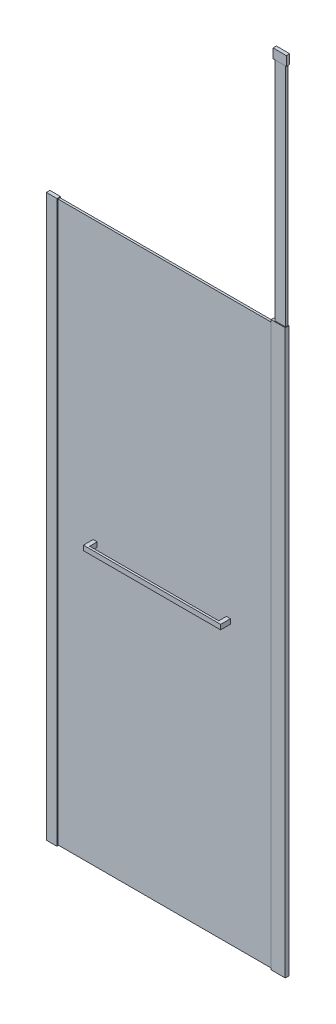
SolidWorks part; units mm, degrees
ref_plane "Płaszczyzna przednia" through (0, 0, 0) normal (0, 0, 1) x (1, 0, 0)
ref_plane "Płaszczyzna górna" through (0, 0, 0) normal (0, 1, 0) x (1, 0, 0)
ref_plane "Płaszczyzna prawa" through (0, 0, 0) normal (1, 0, 0) x (0, 0, -1)
sketch "Szkic1" plane through (0, 0, 0) normal (0, 1, 0) x (1, 0, 0)
  line L0 (0, 0) -> (0, 13.3)
  line L1 (0, 13.3) -> (40, 13.3)
  line L2 (40, 13.3) -> (40, 11.4)
  line L3 (40, 11.4) -> (6.5, 11.4)
  line L4 (6.5, 11.4) -> (6.5, 3.4)
  line L5 (6.5, 3.4) -> (40, 3.4)
  line L6 (40, 3.4) -> (40, 0)
  line L7 (40, 0) -> (0, 0)
  dimension "D1" = 40
  dimension "D2" = 13.3
  dimension "D3" = 33.5
  dimension "D4" = 1.9
  dimension "D5" = 8
extrude "Dodanie-wyciągnięcie1" add sketch "Szkic1" along normal blind 2100 from offset 3
sketch "Szkic2" plane through (0, 3, 0) normal (0, -1, 0) x (1, 0, 0)
  line L0 (6.5, -11.4) -> (40, -11.4) construction
  line L1 (6.5, -3.4) -> (853.5, -3.4)
  line L2 (6.5, -3.4) -> (6.5, -11.4)
  line L3 (6.5, -11.4) -> (853.5, -11.4)
  line L4 (853.5, -3.4) -> (853.5, -11.4)
  dimension "D1" = 847
extrude "Dodanie-wyciągnięcie2" add sketch "Szkic2" against normal blind 2100 separate body
sketch "Szkic3" plane through (0, 3, 0) normal (0, -1, 0) x (1, 0, 0)
  line L0 (843.4, -3.4) -> (843.4, -0.4)
  line L1 (853.5, -3.4) -> (6.5, -3.4) construction
  line L2 (843.4, -0.4) -> (896.4, -0.4)
  line L3 (896.4, -0.4) -> (896.4, -14.4)
  line L4 (896.4, -14.4) -> (843.4, -14.4)
  line L5 (843.4, -14.4) -> (843.4, -11.4)
  line L6 (843.4, -11.4) -> (853.5, -11.4)
  line L7 (853.5, -11.4) -> (853.5, -3.4)
  line L8 (853.5, -3.4) -> (843.4, -3.4)
  line L9 (6.5, -11.4) -> (853.5, -11.4) construction
  line L10 (853.5, -11.4) -> (853.5, -3.4) construction
  dimension "D1" = 10.1
  dimension "D2" = 3
  dimension "D3" = 3
  dimension "D4" = 53
extrude "Dodanie-wyciągnięcie3" add sketch "Szkic3" against normal blind 2108 separate body
sketch "Szkic4" plane through (0, 2103, 0) normal (0, 1, 0) x (1, 0, 0)
  line L1 (0, 13.3) -> (40, 13.3)
  line L2 (0, 13.3) -> (0, 0)
  line L3 (0, 0) -> (40, 0)
  line L4 (40, 13.3) -> (40, 0)
extrude "Dodanie-wyciągnięcie4" add sketch "Szkic4" along normal blind 3
sketch "Szkic5" plane through (0, 2111, 0) normal (0, 1, 0) x (1, 0, 0)
  line L1 (896.4, 14.4) -> (843.4, 14.4)
  line L2 (896.4, 14.4) -> (896.4, 0.4)
  line L3 (896.4, 0.4) -> (843.4, 0.4)
  line L4 (843.4, 14.4) -> (843.4, 0.4)
extrude "Dodanie-wyciągnięcie5" add sketch "Szkic5" along normal blind 3
sketch "Szkic6" plane through (843.4, 0, 0) normal (-1, 0, 0) x (0, 0, 1)
  line L0 (-11.4, 2111) -> (-3.4, 2111) construction
  line L1 (-3.35, 2111) -> (-11.45, 2111)
  line L2 (-3.35, 2111) -> (-3.35, 2103.2)
  line L3 (-3.35, 2103.2) -> (-11.45, 2103.2)
  line L4 (-11.45, 2111) -> (-11.45, 2103.2)
  point P6 (-7.4, 2111)
  dimension "D1" = 8.1
  dimension "D2" = 7.8
extrude "Dodanie-wyciągnięcie6" add sketch "Szkic6" against normal blind 15
sketch "Szkic7" plane through (0, 3, 0) normal (0, -1, 0) x (1, 0, 0)
  line L1 (843.4, -0.4) -> (896.4, -0.4)
  line L2 (843.4, -0.4) -> (843.4, -14.4)
  line L3 (843.4, -14.4) -> (896.4, -14.4)
  line L4 (896.4, -0.4) -> (896.4, -14.4)
extrude "Dodanie-wyciągnięcie7" add sketch "Szkic7" along normal blind 3
sketch "Szkic8" plane through (0, 3, 0) normal (0, -1, 0) x (1, 0, 0)
  line L1 (0, 0) -> (40, 0)
  line L2 (0, 0) -> (0, -13.3)
  line L3 (0, -13.3) -> (40, -13.3)
  line L4 (40, 0) -> (40, -13.3)
extrude "Dodanie-wyciągnięcie8" add sketch "Szkic8" along normal blind 3
sketch "Szkic9" plane through (0, 2114, 2099.6) normal (0, -1, 0) x (-1, 0, 0)
  line L1 (-894.9, 2111) -> (-854.9, 2111)
  line L2 (-894.9, 2111) -> (-894.9, 2103)
  line L3 (-894.9, 2103) -> (-854.9, 2103)
  line L4 (-854.9, 2111) -> (-854.9, 2103)
  line L7 (-843.4, 2114) -> (-896.4, 2114) construction
  line L8 (-896.4, 2114) -> (-896.4, 2100) construction
  dimension "D1" = 3
  dimension "D2" = 1.5
  dimension "D3" = 8
  dimension "D4" = 40
extrude "Dodanie-wyciągnięcie9" add sketch "Szkic9" against normal blind 883 separate body
sketch "Szkic10" plane through (0, 2997, 0) normal (0, 1, 0) x (-1, 0, 0)
  line L0 (-874.9, -11.4) -> (-874.9, -7.4) construction
  line L1 (-899.9, -1.15) -> (-849.9, -1.15)
  line L2 (-899.9, -1.15) -> (-899.9, -13.65)
  line L3 (-899.9, -13.65) -> (-849.9, -13.65)
  line L4 (-849.9, -1.15) -> (-849.9, -13.65)
  line L5 (-899.9, -1.15) -> (-849.9, -13.65) construction
  line L6 (-899.9, -13.65) -> (-849.9, -1.15) construction
  line L7 (-854.9, -11.4) -> (-894.9, -11.4) construction
  line L8 (-874.9, -7.4) -> (-894.9, -7.4) construction
  line L9 (-894.9, -11.4) -> (-894.9, -3.4) construction
  point P0 (-874.9, -7.4)
  dimension "D1" = 12.5
  dimension "D2" = 50
extrude "Dodanie-wyciągnięcie10" add sketch "Szkic10" along normal blind 35 from offset 32
ref_plane "Płaszczyzna1" through (874.9, 0, 0) normal (1, 0, 0) x (0, 0, -1)
sketch "Szkic12" plane through (0, 0, -3.4) normal (0, 0, 1) x (1, 0, 0)
  line L0 (430, 1409.7928) -> (430, 762.3594) construction
  line L1 (180, 1053) -> (680, 1053) construction
  line L2 (6.5, 2103) -> (6.5, 3) construction
  line L3 (853.5, 2103) -> (853.5, 3) construction
  line L5 (172.5, 1062) -> (187.5, 1062)
  line L6 (172.5, 1062) -> (172.5, 1044)
  line L7 (172.5, 1044) -> (187.5, 1044)
  line L8 (187.5, 1062) -> (187.5, 1044)
  line L9 (172.5, 1062) -> (187.5, 1044) construction
  line L10 (172.5, 1044) -> (187.5, 1062) construction
  line L11 (672.5, 1062) -> (687.5, 1062)
  line L12 (672.5, 1062) -> (672.5, 1044)
  line L13 (672.5, 1044) -> (687.5, 1044)
  line L14 (687.5, 1062) -> (687.5, 1044)
  line L15 (672.5, 1062) -> (687.5, 1044) construction
  line L16 (672.5, 1044) -> (687.5, 1062) construction
  dimension "D1" = 1053
  dimension "D2" = 500
  dimension "D3" = 15
  dimension "D4" = 18
extrude "Dodanie-wyciągnięcie11" add sketch "Szkic12" along normal blind 36.5 and the other way blind 18 separate body
sketch "Szkic13" plane through (187.5, 0, 0) normal (1, 0, 0) x (0, 0, -1)
  line L0 (21.4, 1044) -> (-33.1, 1044) construction
  line L1 (-33.1, 1062) -> (-25.1, 1062)
  line L2 (-33.1, 1062) -> (-33.1, 1044)
  line L3 (-33.1, 1044) -> (-25.1, 1044)
  line L4 (-25.1, 1062) -> (-25.1, 1044)
  dimension "D1" = 8
extrude "Dodanie-wyciągnięcie12" add sketch "Szkic13" along normal up to surface (485 mm away)
